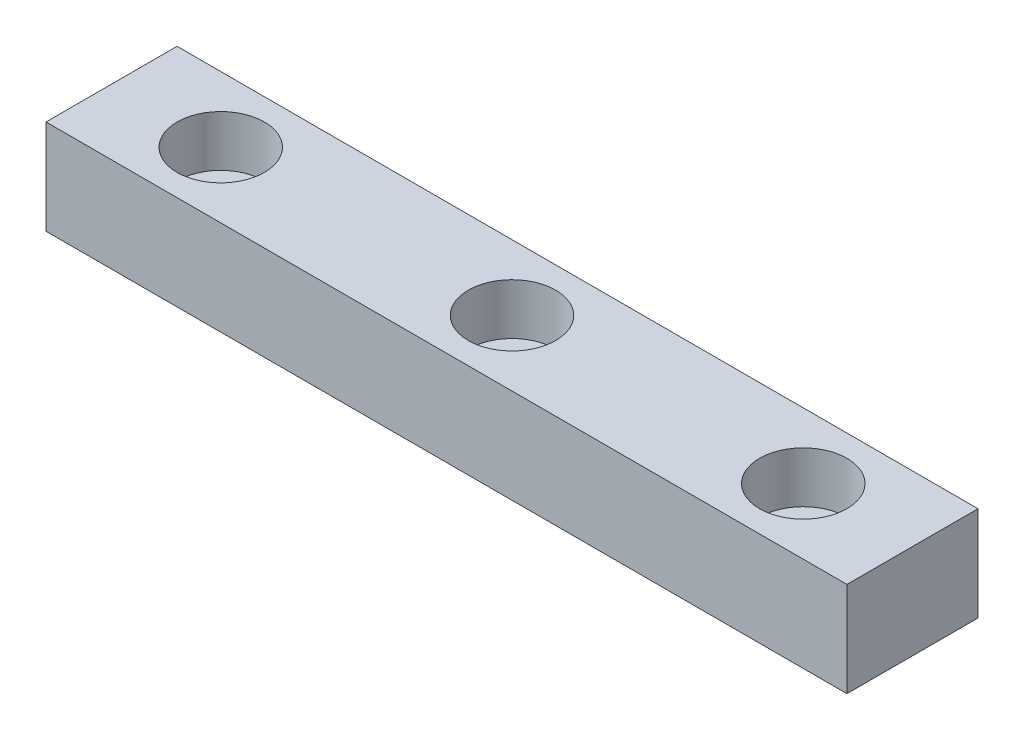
SolidWorks part; units mm, degrees
ref_plane "前视基准面" through (0, 0, 0) normal (0, 0, 1) x (1, 0, 0)
ref_plane "上视基准面" through (0, 0, 0) normal (0, 1, 0) x (1, 0, 0)
ref_plane "右视基准面" through (0, 0, 0) normal (1, 0, 0) x (0, 0, -1)
sketch "草图1" plane through (0, 0, 0) normal (0, 0, 1) x (1, 0, 0)
  line L0 (0, 0) -> (55, 0)
  line L1 (0, 6.5) -> (55, 6.5)
  line L2 (0, 0) -> (0, 6.5)
  line L3 (55, 0) -> (55, 6.5)
extrude "凸台-拉伸1" add sketch "草图1" along normal blind 9
sketch "草图2" plane through (0, 6.5, 0) normal (0, 1, 0) x (1, 0, 0)
  circle A0 centre (7.5, -4.5) radius 1.75
  circle A1 centre (27.5, -4.5) radius 1.75
  circle A2 centre (47.5, -4.5) radius 1.75
extrude "切除-拉伸1" cut sketch "草图2" against normal blind 9
sketch "草图3" plane through (0, 6.5, 0) normal (0, 1, 0) x (1, 0, 0)
  circle A0 centre (47.5, -4.5) radius 3
  circle A1 centre (27.5, -4.5) radius 3
  circle A2 centre (7.5, -4.5) radius 3
extrude "切除-拉伸2" cut sketch "草图3" against normal blind 3.5
